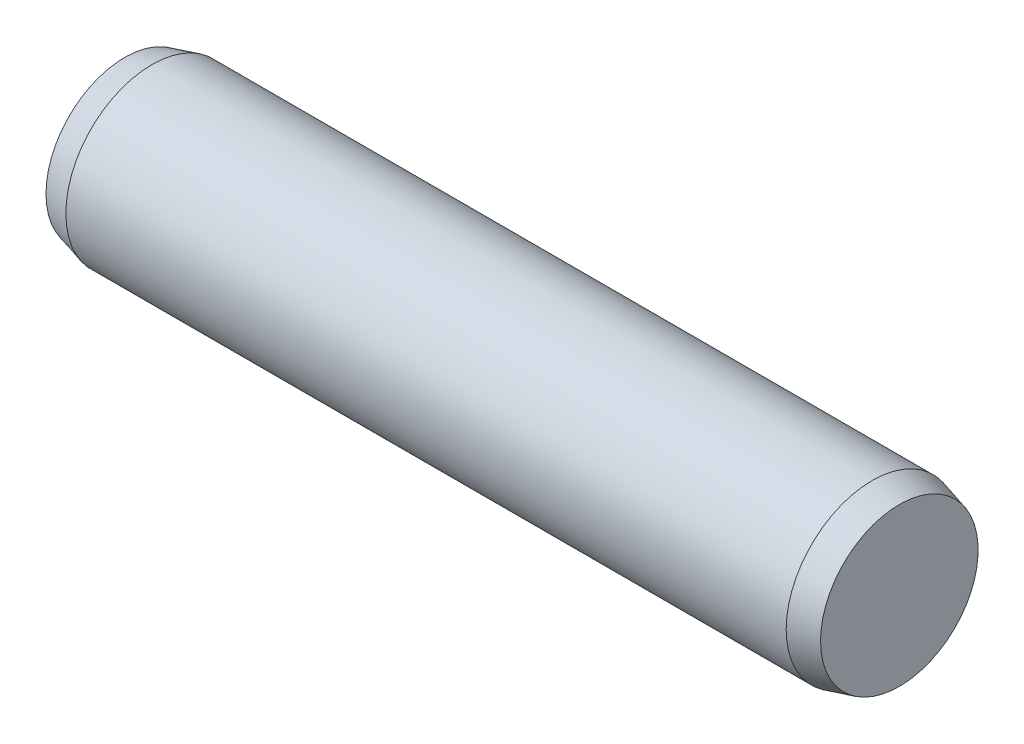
SolidWorks part; units mm, degrees
ref_plane "Plane1" through (0, 0, 0) normal (0, 0, 1) x (1, 0, 0)
ref_plane "Plane2" through (0, 0, 0) normal (0, 1, 0) x (1, 0, 0)
ref_plane "Plane3" through (0, 0, 0) normal (1, 0, 0) x (0, 0, -1)
sketch "Sketch1" plane through (0, 0, 0) normal (0, 0, 1) x (1, 0, 0)
  line L1 (-6.35, 0) -> (107.95, 0) construction
  line L2 (0, 0) -> (18, 0)
  line L3 (18, 0) -> (18, 1.8312)
  line L4 (18, 1.8312) -> (17.37, 2)
  line L5 (17.37, 2) -> (0.63, 2)
  line L6 (0, 1.8312) -> (0, 0)
  line L7 (0, 1.8312) -> (0.63, 2)
revolve "Base-Revolve" add sketch "Sketch1" angle 360 about L1
equation "\"D3@Sketch1\" = 15.0"
equation "\"D1@Sketch1\" = \"Chamfer_len@Sketch1\""
equation "\"D2@Sketch1\" = \"D3@Sketch1\""
